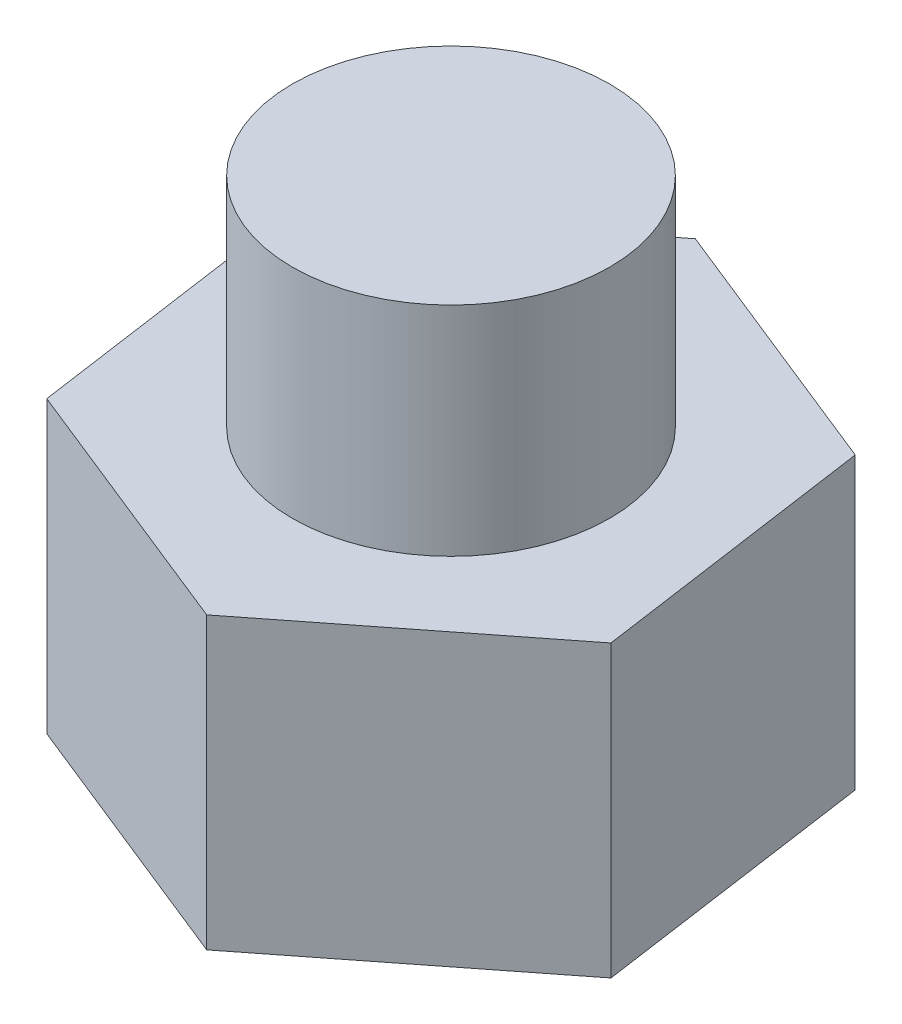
SolidWorks part; units mm, degrees
ref_plane "Front" through (0, 0, 0) normal (0, 0, 1) x (1, 0, 0)
ref_plane "Top" through (0, 0, 0) normal (0, 1, 0) x (1, 0, 0)
ref_plane "Right" through (0, 0, 0) normal (1, 0, 0) x (0, 0, -1)
sketch "Sketch1" plane through (0, 0, 0) normal (0, 1, 0) x (1, 0, 0)
  line L1 (1.4258, -9.9807) -> (9.3564, -3.7555)
  line L2 (9.3564, -3.7555) -> (7.9306, 6.2251)
  line L3 (7.9306, 6.2251) -> (-1.4258, 9.9807)
  line L4 (-1.4258, 9.9807) -> (-9.3564, 3.7555)
  line L5 (-9.3564, 3.7555) -> (-7.9306, -6.2251)
  line L6 (-7.9306, -6.2251) -> (1.4258, -9.9807)
  circle A0 centre (0, 0) radius 8.7313 construction
  dimension "D1" = 17.4625
extrude "Extrude1" add sketch "Sketch1" along normal blind 12.7
sketch "Sketch2" plane through (0, 12.7, 0) normal (0, 1, 0) x (-1, 0, 0)
  circle A0 centre (0, 0) radius 5.5562
  dimension "D1" = 11.1125
extrude "Extrude2" add sketch "Sketch2" along normal blind 7.62
sketch "Sketch3" plane through (0, 0, 0) normal (0, -1, 0) x (1, 0, 0)
  circle A0 centre (0, 0) radius 12.9515
  circle A1 centre (0, 0) radius 5.08
extrude "Cut-Extrude1" cut sketch "Sketch3" against normal blind 2.54
